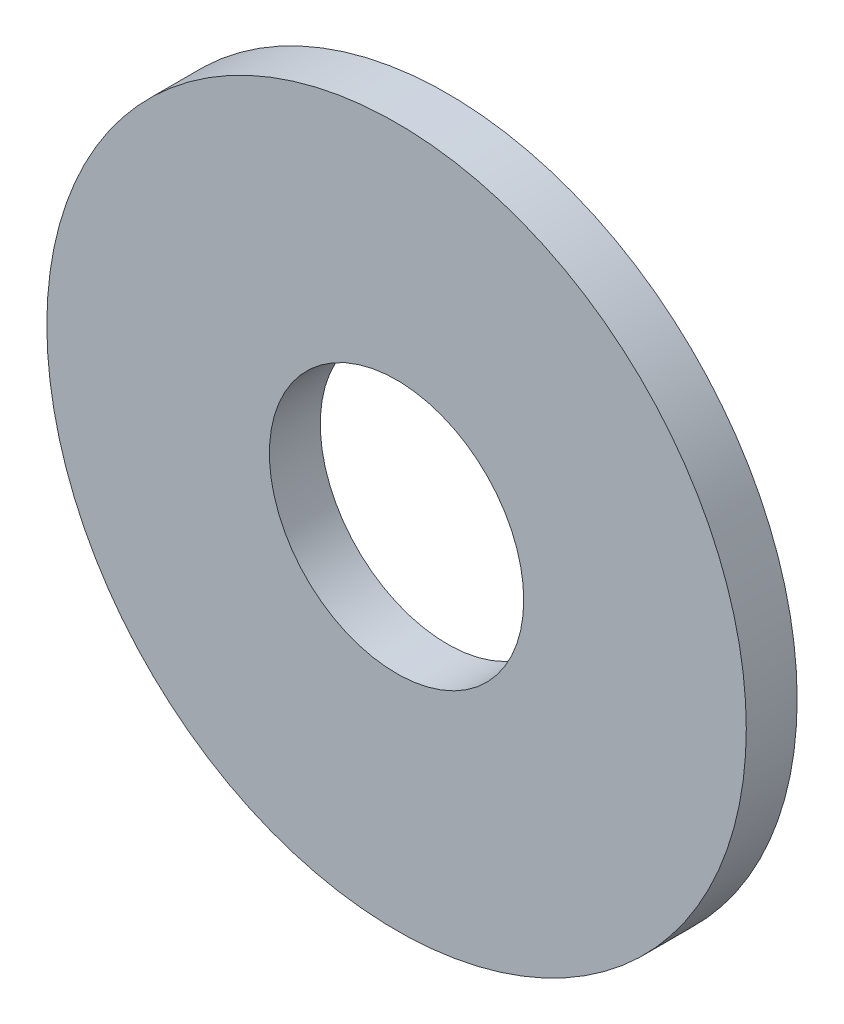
SolidWorks part; units mm, degrees
ref_plane "Plan de face" through (0, 0, 0) normal (0, 0, 1) x (1, 0, 0)
ref_plane "Plan de dessus" through (0, 0, 0) normal (0, 1, 0) x (1, 0, 0)
ref_plane "Plan de droite" through (0, 0, 0) normal (1, 0, 0) x (0, 0, -1)
sketch "Esquisse1" plane through (0, 0, 0) normal (0, 0, 1) x (1, 0, 0)
  circle A0 centre (0, 0) radius 27.5
  circle A1 centre (0, 0) radius 10
  dimension "D1" = 20
  dimension "D2" = 55
extrude "Boss.-Extru.1" add sketch "Esquisse1" along normal blind 4
